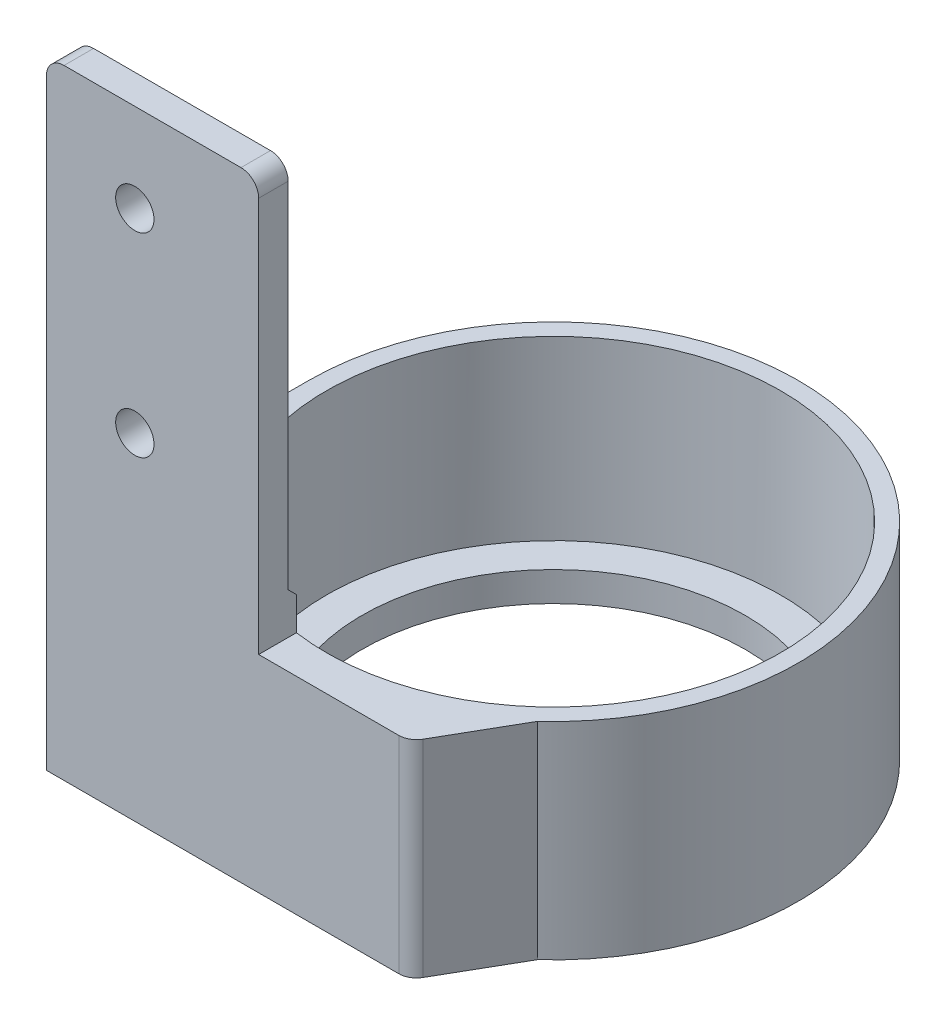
SolidWorks part; units mm, degrees
ref_plane "Ebene vorne" through (0, 0, 0) normal (0, 0, 1) x (1, 0, 0)
ref_plane "Ebene oben" through (0, 0, 0) normal (0, 1, 0) x (1, 0, 0)
ref_plane "Ebene rechts" through (0, 0, 0) normal (1, 0, 0) x (0, 0, -1)
sketch "Skizze1" plane through (0, 0, 0) normal (0, 0, 1) x (1, 0, 0)
  line L0 (18, 0) -> (18, -105) construction
  line L1 (3, 0) -> (33, 0)
  line L2 (0, -3) -> (0, -97)
  line L3 (3, -105) -> (33, -105)
  line L4 (36, -3) -> (36, -97)
  line L5 (0, -63) -> (36, -63) construction
  line L6 (33, -105) -> (36, -105)
  line L7 (36, -105) -> (36, -97)
  line L8 (0, -97) -> (0, -105)
  line L9 (0, -105) -> (3, -105)
  circle A2 centre (15, -15) radius 3.25
  circle A3 centre (15, -48) radius 3.25
  arc A6 (3, 0) -> (0, -3) centre (3, -3) ccw
  arc A7 (33, 0) -> (36, -3) centre (33, -3) cw
  point P18 (36, -105)
  point P21 (0, 0)
  point P24 (36, 0)
  dimension "D3" = 15
  dimension "D4" = 15
  dimension "D5" = 6.5
  dimension "D6" = 6.5
  dimension "D7" = 15
  dimension "D1" = 36
  dimension "D2" = 105
  dimension "D8" = 42
  dimension "D9" = 15
extrude "Aufsatz-Linear austragen1" add sketch "Skizze1" along normal blind 3
sketch "Skizze4" plane through (0, -105, 0) normal (0, -1, 0) x (1, 0, 0)
  line L0 (0, 3) -> (36, 3) construction
  line L1 (0, -20.5722) -> (0, 101.0705) construction
  line L2 (41.5, 44.5) -> (-50.319, 44.5) construction
  circle A0 centre (41.5, 44.5) radius 41.5
  point P7 (0, 44.5)
other "AusrichtungGruppe1" parameters "D1"=51.6821, "D2"=82, "D3"=82
extrude "Aufsatz-Linear austragen2" add sketch "Skizze4" against normal blind 35 separate body
sketch "Skizze6" plane through (0, -105, 0) normal (0, -1, 0) x (-1, 0, 0)
  circle A0 centre (-41.5, -44.5) radius 38.5
  dimension "D1" = 77
extrude "Schnitt-Linear austragen1" cut sketch "Skizze6" against normal through all
sketch "Skizze7" plane through (0, -70, 0) normal (0, 1, 0) x (1, 0, 0)
  circle A0 centre (41.5, -44.5) radius 32.5
  dimension "D1" = 65
extrude "Linear-Austragen-Dünn1" add sketch "Skizze7" against normal blind 5 from offset 30 thin
sketch "Skizze16" plane through (0, 0, 0) normal (0, 0, -1) x (-1, 0, 0)
  line L0 (0, -70) -> (-83, -70) construction
  line L1 (-36, -105) -> (-61.5, -105)
  line L2 (-36, -105) -> (-36, -70)
  line L3 (-36, -70) -> (-61.5, -70)
  line L4 (-61.5, -105) -> (-61.5, -70)
  dimension "D1" = 25.5
extrude "Aufsatz-Linear austragen3" add sketch "Skizze16" against normal blind 3
sketch "Skizze17" plane through (0, -105, 0) normal (0, -1, 0) x (1, 0, 0)
  line L0 (41.5, 12) -> (41.5, -5.5591) construction
  line L2 (65.4633, 10.6177) -> (69.4531, 13.8263)
  line L3 (61.1577, 7.9511) -> (65.4633, 10.6177)
  line L4 (56.4564, 5.7888) -> (61.1577, 7.9511)
  line L5 (51.631, 4.2556) -> (56.4564, 5.7888)
  line L6 (46.5811, 3.3122) -> (51.631, 4.2556)
  line L7 (46.5811, 3.3122) -> (41.5, 3)
  line L8 (0, 3) -> (61.5, 3) construction
  line L10 (61.5, 3) -> (41.5, 3)
  line L11 (69.4531, 13.8263) -> (61.5, 0)
  line L12 (61.5, 0) -> (61.5, 3)
  line L13 (41.5, 3) -> (61.5, 3)
  circle A0 centre (41.5, 44.5) radius 32.5 construction
  circle A1 centre (41.5, 44.5) radius 41.5 construction
  point P10 (46.5811, 3.3122)
  point P11 (51.631, 4.2556)
  point P12 (56.4564, 5.7888)
  point P13 (61.1577, 7.9511)
  point P14 (65.4633, 10.6177)
extrude "Aufsatz-Linear austragen4" add sketch "Skizze17" against normal blind 35
sketch "Skizze19" plane through (0, -105, 0) normal (0, -1, 0) x (1, 0, 0)
  line L2 (0, 44.5) -> (0.2928, 39.5792)
  line L3 (0.2928, 39.5792) -> (1.3201, 34.116)
  line L4 (1.3201, 34.116) -> (2.9875, 29.0393)
  line L5 (2.9875, 29.0393) -> (5.4052, 24.0204)
  line L6 (5.4052, 24.0204) -> (8.4399, 19.4145)
  line L7 (8.4399, 19.4145) -> (12.0006, 15.3103)
  line L8 (12.0006, 15.3103) -> (16.1589, 11.6355)
  line L9 (16.1589, 11.6355) -> (20.6222, 8.6341)
  line L10 (20.6222, 8.6341) -> (25.5345, 6.1939)
  line L11 (25.5345, 6.1939) -> (30.6999, 4.43)
  line L12 (30.6999, 4.43) -> (36.0384, 3.361)
  line L13 (36.0384, 3.361) -> (41.5, 3)
  line L14 (0, 3) -> (0, 44.5)
  line L15 (41.5, 3) -> (0, 3)
  circle A0 centre (41.5, 44.5) radius 41.5 construction
  point P7 (36.0384, 3.361)
  point P10 (30.6999, 4.43)
  point P11 (25.5345, 6.1939)
  point P12 (20.6222, 8.6341)
  point P13 (16.1589, 11.6355)
  point P14 (12.0006, 15.3103)
  point P15 (8.4399, 19.4145)
  point P16 (5.4052, 24.0204)
  point P17 (2.9875, 29.0393)
  point P18 (1.2971, 34.2053)
  point P19 (0.2928, 39.5792)
extrude "Aufsatz-Linear austragen5" add sketch "Skizze19" against normal blind 35
sketch3d "3D-Skizze1"
  point P0 (41.7889, -78.459, 85.999)
ref_plane "Ebene1" through (0, 0, 85.999) normal (0, 0, 1) x (1, 0, 0)
sketch "Skizze20" plane through (0, 0, 85.999) normal (0, 0, 1) x (1, 0, 0)
  line L0 (83, -70) -> (0, -70) construction
  line L3 (0, -105) -> (83, -105) construction
  line L5 (-44.701, -98) -> (109.682, -98) construction
  line L31 (-30.7141, -77) -> (172.708, -77) construction
  line L32 (-23.44, -98) -> (16.56, -98)
  line L57 (16.56, -98) -> (-3.44, -77)
  line L64 (21.56, -77) -> (21.56, -98) construction
  line L65 (-3.44, -77) -> (-23.44, -98)
  line L67 (-3.44, -77) -> (-3.44, -98) construction
  line L74 (21.56, -98) -> (41.56, -77)
  line L75 (41.56, -77) -> (1.56, -77)
  line L76 (1.56, -77) -> (21.56, -98)
  line L90 (66.56, -98) -> (26.56, -98)
  line L91 (26.56, -98) -> (46.56, -77)
  line L92 (46.56, -77) -> (46.56, -98) construction
  line L93 (46.56, -77) -> (66.56, -98)
  line L94 (51.56, -77) -> (91.56, -77)
  line L95 (71.56, -98) -> (51.56, -77)
  line L96 (71.56, -77) -> (71.56, -98) construction
  line L97 (91.56, -77) -> (71.56, -98)
  line L98 (76.56, -98) -> (116.56, -98)
  line L99 (96.56, -77) -> (76.56, -98)
  line L100 (96.56, -77) -> (96.56, -98) construction
  line L101 (116.56, -98) -> (96.56, -77)
  line L102 (141.56, -77) -> (101.56, -77)
  line L103 (101.56, -77) -> (121.56, -98)
  line L104 (121.56, -77) -> (121.56, -98) construction
  line L105 (121.56, -98) -> (141.56, -77)
  line L106 (126.56, -98) -> (141.56, -98)
  line L107 (126.56, -98) -> (146.56, -77)
  line L108 (146.56, -77) -> (146.56, -98)
  line L109 (146.56, -98) -> (141.56, -98)
  dimension "D1" = 7
  dimension "D2" = 40
  dimension "D3" = 5
  dimension "D4" = 7
  dimension "D5" = 5
  dimension "D6" = 40
  dimension "D7" = 5
  dimension "D8" = 5
wrap "Umwickeln1" [suppressed] sketch "Skizze20" source sketch "Skizze20" thickness 5 parameters "D1"=5
sketch "Skizze21" plane through (0, -70, 0) normal (0, 1, 0) x (1, 0, 0)
  line L10 (55.4486, 0) -> (59.7647, 0)
  line L11 (36, 0) -> (61.5, 0) construction
  line L12 (62.3652, -1.5042) -> (64.3465, -4.9487)
  line L13 (69.4531, -13.8263) -> (61.5, 0) construction
  line L14 (64.3465, -4.9487) -> (55.4486, 0)
  line L15 (59.7647, 0) -> (61.5, 0)
  line L16 (61.5, 0) -> (62.3652, -1.5042)
  arc A0 (59.7647, 0) -> (62.3652, -1.5042) centre (59.7647, -3) cw
  point P12 (61.5, 0)
  dimension "D1" = 3
extrude "Schnitt-Linear austragen3" cut sketch "Skizze21" against normal through all contours A0 M4 M3
sketch "Skizze23" plane through (0, 0, 0) normal (0, 0, -1) x (-1, 0, 0)
  line L0 (-15, -15) -> (-15, -48) construction
  line L1 (-36, -70) -> (0, -70) construction
sketch "Skizze24" [suppressed] plane through (0, 0, 0) normal (-1, 0, 0) x (0, 0, 1)
  line L0 (79.7239, -125) -> (0, -125) construction
  line L1 (0, -3) -> (0, -132) construction
  line L2 (0, -74) -> (77.1095, -74) construction
  line L9 (78.7288, -125) -> (44.748, -125) construction
  line L10 (68.2191, -74) -> (86, -74) construction
  line L11 (19.748, -74) -> (59.748, -74)
  line L15 (19.748, -74) -> (39.748, -125)
  line L16 (39.748, -125) -> (59.748, -74)
  line L18 (39.748, -125) -> (39.748, -74) construction
  line L19 (14.748, -74) -> (14.748, -125)
  line L20 (14.748, -74) -> (34.748, -125)
  line L21 (14.748, -125) -> (34.748, -125)
  point P12 (14.748, -74)
  dimension "D1" = 5
  dimension "D2" = 20
  dimension "D3" = 20
  dimension "D4" = 4.2062
  dimension "D5" = 5
  dimension "D6" = 5
extrude "Schnitt-Linear austragen4" [suppressed] cut sketch "Skizze24" against normal blind 15
sketch "Skizze29" plane through (0, 0, 3) normal (0, 0, 1) x (1, 0, 0)
  line L1 (3, 0) -> (33, 0)
  line L2 (0, -3) -> (0, -70)
  line L3 (0, -70) -> (36, -70)
  line L4 (36, -3) -> (36, -70)
  arc A0 (33, 0) -> (36, -3) centre (33, -3) cw
  arc A1 (3, 0) -> (0, -3) centre (3, -3) ccw
  circle A2 centre (15, -15) radius 3.25
  circle A3 centre (15, -48) radius 3.25
  point P10 (0, 0)
  dimension "D1" = 3
extrude "Aufsatz-Linear austragen8" add sketch "Skizze29" along normal blind 2
sketch "Skizze26" plane through (0, 0, 0) normal (-1, 0, 0) x (0, 0, 1)
  line L5 (5, -70) -> (5, -63)
  line L6 (5, -3) -> (5, -70) construction
  line L7 (5, -70) -> (12, -70)
  line L8 (44.5, -70) -> (5, -70) construction
  line L9 (5, -63) -> (12, -70)
  dimension "D1" = 7
  dimension "D2" = 7
extrude "Aufsatz-Linear austragen6" add sketch "Skizze26" against normal blind 36
sketch "Skizze31" plane through (0, -70, 0) normal (0, 1, 0) x (1, 0, 0)
  circle A0 centre (41.5, -44.5) radius 38.5
extrude "Schnitt-Linear austragen5" cut sketch "Skizze31" along normal blind 10
mirror "Spiegeln1" about plane through (3, -3, 5) normal (0, 0, 1)
delete or keep bodies "Körper-Löschen/beibehalten 1" type delete bodies bodies 123
